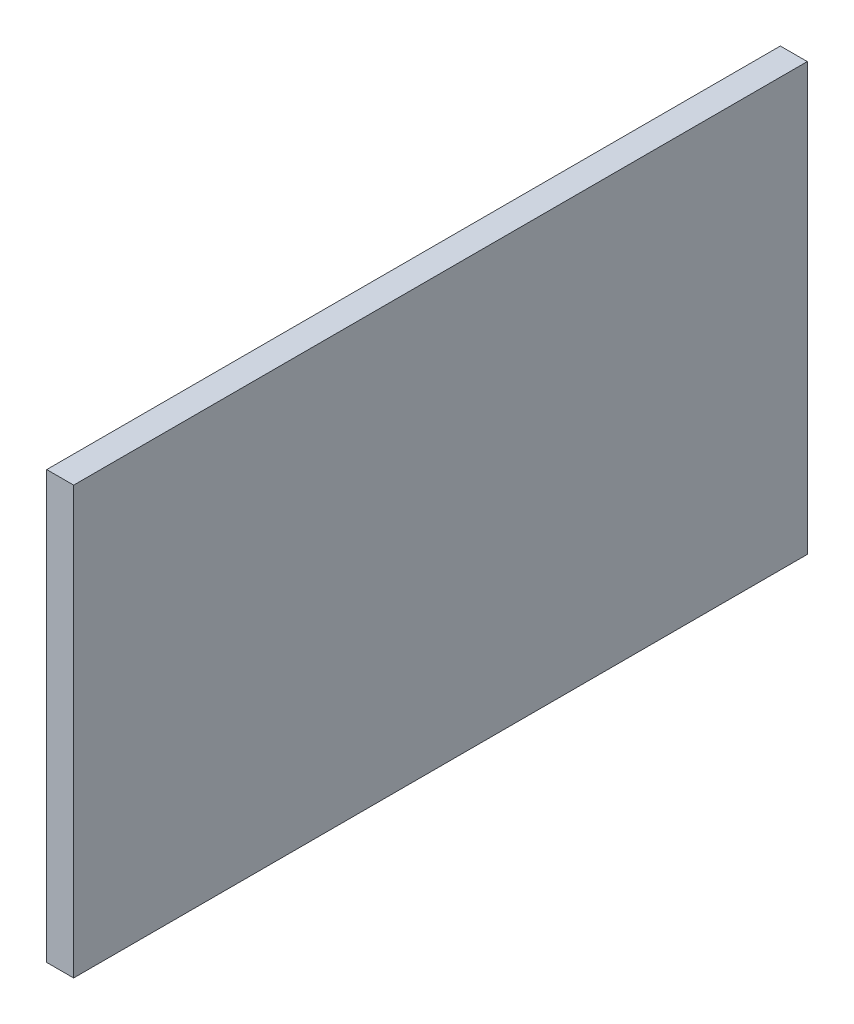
SolidWorks part; units mm, degrees
ref_plane "Plano frontal" through (0, 0, 0) normal (0, 0, 1) x (1, 0, 0)
ref_plane "Plano superior" through (0, 0, 0) normal (0, 1, 0) x (1, 0, 0)
ref_plane "Plano direito" through (0, 0, 0) normal (1, 0, 0) x (0, 0, -1)
sketch "Esboço2" plane through (0, 0, 0) normal (0, 0, 1) x (1, 0, 0)
  line L0 (263, -18) -> (263, 49982) construction
  line L1 (281, -18) -> (281, 49982) construction
  line L3 (-719.0211, 647.5) -> (49280.9789, 647.5) construction
  line L4 (-719.0211, 932.5) -> (49280.9789, 932.5) construction
  line L5 (263, 932.6025) -> (281, 932.6025)
  line L6 (263, 932.6025) -> (263, 647.5)
  line L7 (263, 647.5) -> (280.9789, 647.5)
  line L8 (281, 932.6025) -> (280.9789, 647.5)
  dimension "D1" = 285
extrude "Ressalto-extrusão1" add sketch "Esboço2" against normal blind 490
